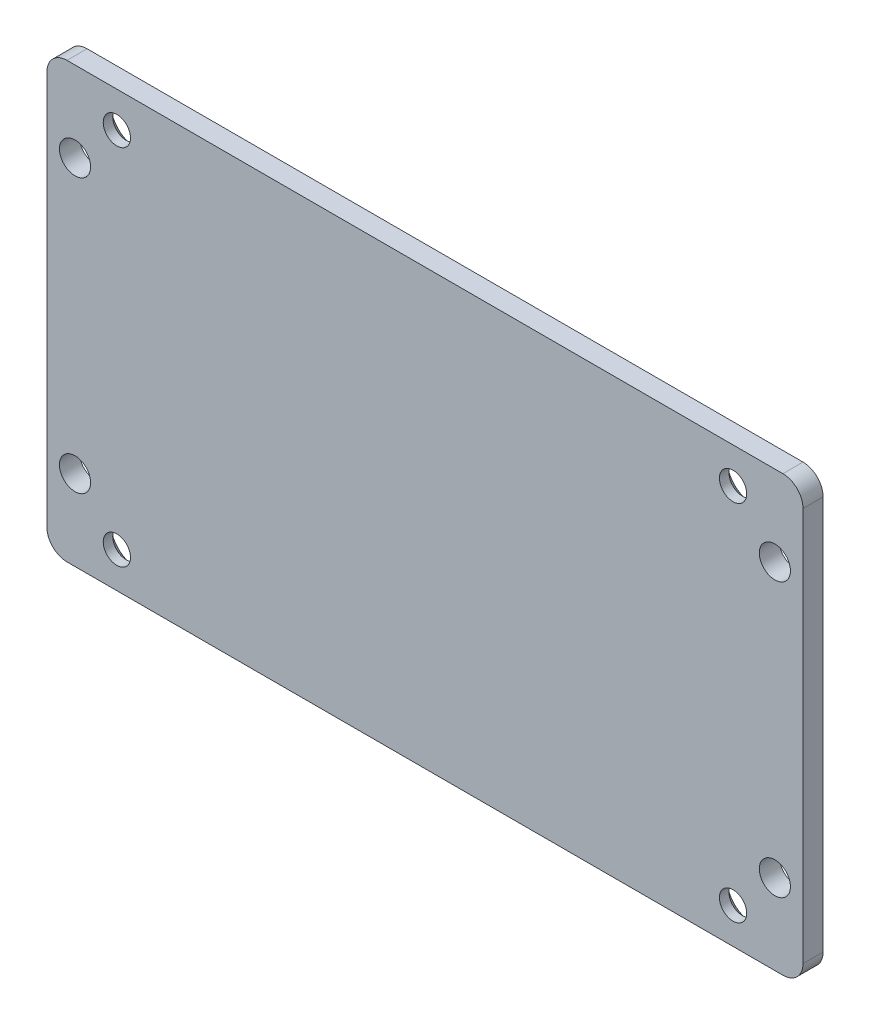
SolidWorks part; units mm, degrees
ref_plane "Front Plane" through (0, 0, 0) normal (0, 0, 1) x (1, 0, 0)
ref_plane "Top Plane" through (0, 0, 0) normal (0, 1, 0) x (1, 0, 0)
ref_plane "Right Plane" through (0, 0, 0) normal (1, 0, 0) x (0, 0, -1)
sketch "Sketch1" plane through (0, 0, 0) normal (0, 0, 1) x (1, 0, 0)
  line L0 (-56.515, -34.29) -> (56.515, -34.29)
  line L1 (0, 0) -> (-32.536, 0) construction
  line L2 (-59.69, -31.115) -> (-59.69, 31.115)
  line L3 (-56.515, 34.29) -> (56.515, 34.29)
  line L4 (59.69, -31.115) -> (59.69, 31.115)
  line L5 (-59.69, -34.29) -> (59.69, 34.29) construction
  line L6 (-59.69, 34.29) -> (59.69, -34.29) construction
  line L9 (0, -33.3756) -> (0, 0) construction
  line L16 (50.8, 30.8356) -> (50.8, -30.8356) construction
  arc A2 (-59.69, 31.115) -> (-56.515, 34.29) centre (-56.515, 31.115) cw
  arc A3 (56.515, -34.29) -> (59.69, -31.115) centre (56.515, -31.115) ccw
  arc A4 (56.515, 34.29) -> (59.69, 31.115) centre (56.515, 31.115) cw
  arc A5 (-59.69, -31.115) -> (-56.515, -34.29) centre (-56.515, -31.115) ccw
  point P0 (0, 0)
  dimension "D1" = 68.58
  dimension "D2" = 3.175
  dimension "D4" = 8.89
extrude "Boss-Extrude1" add sketch "Sketch1" along normal blind 3.175
hole_wizard "CSK for #6 Flat Head Machine Screw (100)1" positions "Sketch7" profile "Sketch6" countersink size "#6" standard "ANSI Inch"
sketch "Sketch7" plane through (0, 0, 0) normal (0, 0, -1) x (-1, 0, 0)
  circle A0 centre (-48.641, 28.6766) radius 1.3525 construction
  circle A1 centre (-48.641, -28.6766) radius 1.3525 construction
  circle A2 centre (48.641, 28.6766) radius 1.3525 construction
  circle A3 centre (48.641, -28.6766) radius 1.3525 construction
  point P0 (-48.641, -28.6766)
  point P3 (-48.641, 28.6766)
  point P6 (48.641, 28.6766)
  point P9 (48.641, -28.6766)
sketch "Sketch6" plane through (48.641, -28.6766, 0) normal (1, 0, 0) x (0, 1, 0)
  line L0 (0, 0) -> (0, 7.6434)
  line L1 (0, 7.6434) -> (2.1526, 6.35)
  line L2 (2.1526, 6.35) -> (2.1526, 1.6749)
  line L3 (2.1526, 1.6749) -> (4.1487, 0)
  line L5 (4.1487, 0) -> (0, 0)
  line L6 (-2.1526, 1.6749) -> (-4.1487, 0) construction
  line L10 (0, 7.6434) -> (-2.1527, 6.35) construction
  line L11 (0, -6.35) -> (0, 107.95) construction
  dimension "Hole Dia." = 4.3053
  dimension "Hole Depth" = 6.35
  dimension "Near C'Sink Dia." = 8.2974
  dimension "Near C'Sink Angle" = 100
  dimension "Drill Angle" = 118
hole_wizard "#10 (0.1935) Diameter Hole1" positions "Sketch5" profile "Sketch4" hole size "#10" standard "ANSI Inch"
sketch "Sketch5" plane through (0, 0, 3.175) normal (0, 0, 1) x (1, 0, 0)
  line L1 (-55.245, -21.59) -> (55.245, -21.59) construction
  line L2 (-55.245, -21.59) -> (-55.245, 21.59) construction
  line L3 (-55.245, 21.59) -> (55.245, 21.59) construction
  line L4 (55.245, -21.59) -> (55.245, 21.59) construction
  line L6 (-55.245, 0) -> (0, 0) construction
  line L7 (0, 0) -> (0, 21.59) construction
  line L9 (-59.69, 31.115) -> (-59.69, -31.115) construction
  line L10 (-56.515, -34.29) -> (56.515, -34.29) construction
  point P0 (-55.245, -21.59)
  point P2 (55.245, -21.59)
  point P4 (55.245, 21.59)
  point P6 (-55.245, 21.59)
  dimension "D1" = 12.7
  dimension "D2" = 4.445
sketch "Sketch4" plane through (-55.245, -21.59, 3.175) normal (1, 0, 0) x (0, -1, 0)
  line L0 (0, 0) -> (0, 3.175)
  line L1 (0, 3.175) -> (2.4574, 3.175)
  line L2 (2.4574, 3.175) -> (2.4574, 0)
  line L5 (2.4574, 0) -> (0, 0)
  line L11 (0, -6.35) -> (0, 107.95) construction
  dimension "Thru Hole Dia." = 4.9149
  dimension "Thru Hole Depth" = 3.175
